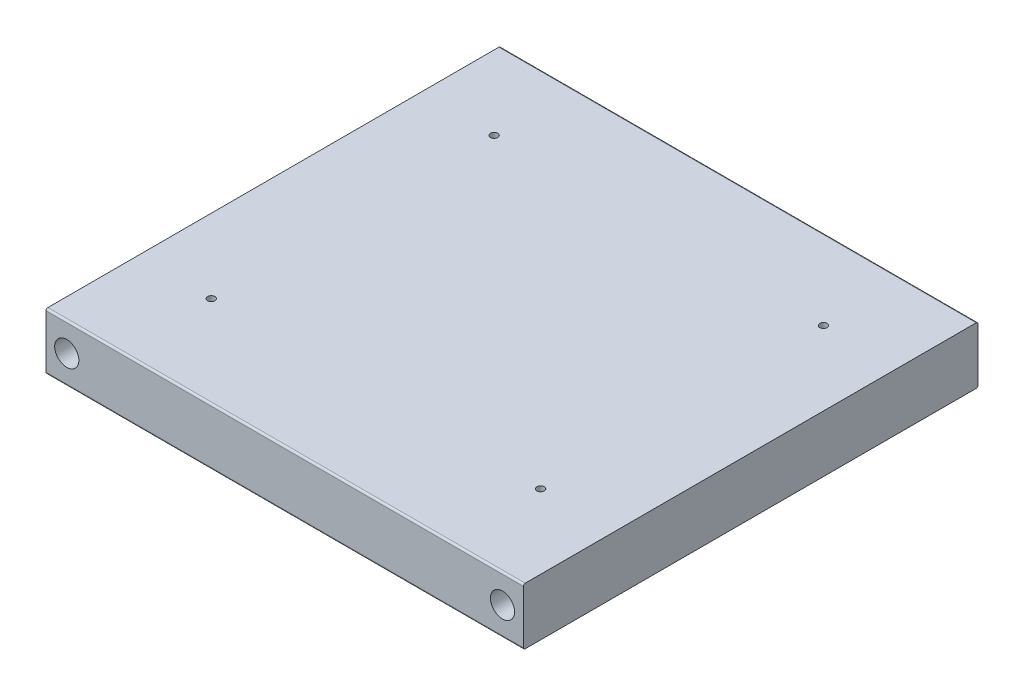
SolidWorks part; units mm, degrees
ref_plane "Front Plane" through (0, 0, 0) normal (0, 0, 1) x (1, 0, 0)
ref_plane "Top Plane" through (0, 0, 0) normal (0, 1, 0) x (1, 0, 0)
ref_plane "Right Plane" through (0, 0, 0) normal (1, 0, 0) x (0, 0, -1)
sketch "Sketch1" plane through (0, 0, 0) normal (0, 1, 0) x (1, 0, 0)
  line L1 (-66.675, -63.5) -> (66.675, -63.5) construction
  line L2 (-66.675, -63.5) -> (-66.675, 63.5) construction
  line L3 (-66.675, 63.5) -> (66.675, 63.5) construction
  line L4 (66.675, -63.5) -> (66.675, 63.5) construction
  line L5 (-66.675, -63.5) -> (66.675, 63.5) construction
  line L6 (-66.675, 63.5) -> (66.675, -63.5) construction
  point P0 (0, 0)
  dimension "Length" = 133.35
  dimension "Width" = 127
sketch "Sketch2" plane through (0, 0, 0) normal (1, 0, 0) x (0, 0, -1)
  line L0 (63.5, 7.9375) -> (63.5, -7.9375) construction
sketch "Sketch3" plane through (0, 0, 0) normal (0, 1, 0) x (1, 0, 0)
  line L1 (-66.675, 63.5) -> (66.675, 63.5)
  line L2 (-66.675, 63.5) -> (-66.675, -63.5)
  line L3 (-66.675, -63.5) -> (66.675, -63.5)
  line L4 (66.675, 63.5) -> (66.675, -63.5)
extrude "Boss-Extrude1" add sketch "Sketch3" along normal up to vertex (7.9375 mm away) and the other way up to vertex (7.9375 mm away)
fillet "Fillet1" radius 0.5239 4 edges at (0, -7.9375, -63.5) (0, 7.9375, -63.5) (0, -7.9375, 63.5) (0, 7.9375, 63.5)
hole_wizard "M2.5x0.45 Tapped Hole1" positions "Sketch5" profile "Sketch6" tap size "M2.5x0.45" standard "ANSI Metric"
sketch "Sketch5" plane through (0, -7.9375, 0) normal (0, -1, 0) x (-1, 0, 0)
  point P0 (-46, 41)
  point P3 (46, 41)
  point P6 (46, -38)
  point P9 (-46, -38)
sketch "Sketch6" plane through (46, -7.9375, -41) normal (1, 0, 0) x (0, 0, -1)
  line L0 (0, 0) -> (0, 15.875)
  line L1 (0, 15.875) -> (1.025, 15.875)
  line L2 (1.025, 15.875) -> (1.025, 0)
  line L5 (1.025, 0) -> (0, 0)
  line L11 (0, -6.35) -> (0, 107.95) construction
  dimension "Thru Tap Drill Dia." = 2.05
  dimension "Thru Tap Drill Depth" = 15.875
sketch "Sketch7" plane through (0, 0, 63.5) normal (0, 0, 1) x (1, 0, 0)
  circle A0 centre (-60.877, 0.0039) radius 3.3782
  circle A2 centre (60.8375, 0.002) radius 3.3782
extrude "Cut-Extrude1" cut sketch "Sketch7" against normal up to next
equation "\"D1@Fillet1\"=\"Thickness@Sketch2\"*.033"
